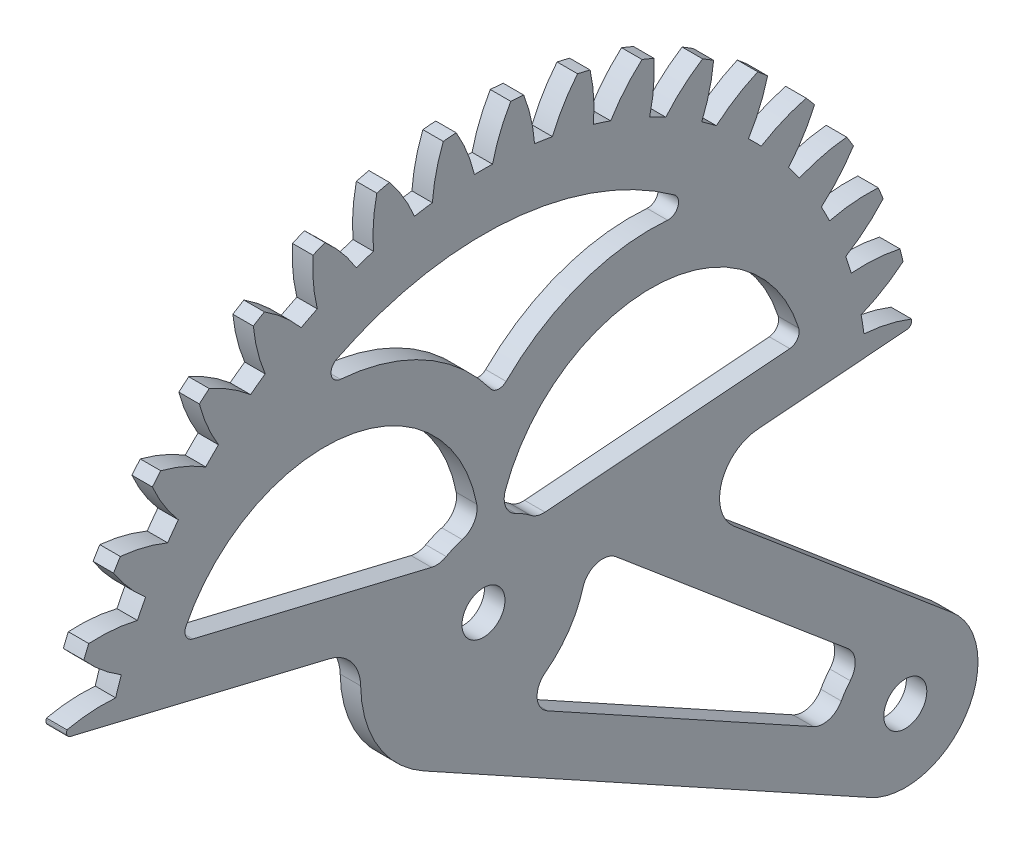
SolidWorks part; units mm, degrees
other "Bore"
ref_plane "Plan de face" through (0, 0, 0) normal (0, 0, 1) x (1, 0, 0)
ref_plane "Plan de dessus" through (0, 0, 0) normal (0, 1, 0) x (1, 0, 0)
ref_plane "Plan de droite" through (0, 0, 0) normal (1, 0, 0) x (0, 0, -1)
imported_body "Importée1"
sketch "Esquisse1" plane through (2, 0, 0) normal (1, 0, 0) x (0, 0, -1)
  line L0 (0, 0) -> (3.2953, 41.8705) construction
  line L1 (11.963, 0.9415) -> (41.8705, 3.2953)
  line L2 (-11.6684, 2.8013) -> (-40.8395, 9.8047)
  line L3 (-11.6684, 2.8013) -> (0, 0) construction
  line L4 (0, 0) -> (11.963, 0.9415) construction
  arc A0 (3.9259, 41.8161) -> (2.664, 41.9154) centre (0, 0) ccw construction
  arc A1 (41.9154, 2.664) -> (41.8161, 3.9259) centre (0, 0) ccw construction
  arc A2 (-40.6872, 10.419) -> (-40.9826, 9.1882) centre (0, 0) ccw construction
  arc A3 (-40.8395, 9.8047) -> (41.8705, 3.2953) centre (0, 0) ccw
  arc A4 (11.963, 0.9415) -> (-11.6684, 2.8013) centre (0, 0) cw
  dimension "D1" = 12
extrude "Enlèv. mat.-Extru.1" cut sketch "Esquisse1" against normal through all
sketch "Esquisse2" plane through (2, 0, 0) normal (1, 0, 0) x (0, 0, -1)
  line L0 (0, 0) -> (3.2953, 41.8705) construction
  line L1 (0, 0) -> (41.2063, -28.3203) construction
  line L2 (45.7819, -22.8913) -> (17.0304, 1.3403)
  line L3 (41.8705, 3.2953) -> (11.963, 0.9415) construction
  line L4 (17.0304, 1.3403) -> (11.963, 0.9415)
  line L5 (-5.795, -10.508) -> (37.7776, -34.5375)
  line L6 (20.6032, -14.1602) -> (26.0385, -6.2517) construction
  line L7 (20.6032, -14.1602) -> (15.1678, -22.0686) construction
  arc A0 (3.9259, 41.8161) -> (2.664, 41.9154) centre (0, 0) ccw construction
  circle A1 centre (41.2063, -28.3203) radius 2.1
  arc A2 (45.7819, -22.8913) -> (37.7776, -34.5375) centre (41.2063, -28.3203) cw
  arc A4 (11.963, 0.9415) -> (-5.795, -10.508) centre (0, 0) cw
  arc A6 (-11.6684, 2.8013) -> (11.963, 0.9415) centre (0, 0) ccw construction
  dimension "D2" = 4.2
  dimension "D4" = 5
  dimension "D1" = 120
  dimension "D3" = 50
extrude "Boss.-Extru.1" add sketch "Esquisse2" against normal up to surface (2 mm away)
fillet "Congé1" radius 4 2 edges at (1, 2.8013, 11.6684) (1, 1.3403, -17.0304)
fillet "Congé2" radius 0.5 2 edges at (1, 9.8047, 40.8395) (1, 3.2953, -41.8705)
sketch "Esquisse3" plane through (0, 0, 0) normal (-1, 0, 0) x (0, 0, 1)
  circle A0 centre (0, 0) radius 4
  circle A1 centre (0, 0) radius 2.1
  circle A2 centre (0, 0) radius 4 construction
  dimension "D1" = 4.2
extrude "Boss.-Extru.2" add sketch "Esquisse3" against normal up to surface (2 mm away)
sketch "Esquisse4" plane through (0, 0, 0) normal (-1, 0, 0) x (0, 0, 1)
  line L2 (13.8967, 8.4784) -> (39.1832, 14.5491)
  line L3 (5.0779, 6.3612) -> (29.5664, 12.2403)
  line L4 (0, 0) -> (-3.2953, 41.8705) construction
  line L5 (-40.9768, 8.2404) -> (-26.3552, 7.0897)
  line L6 (-31.1172, 7.4644) -> (-6.0105, 5.4885)
  line L7 (0, 0) -> (0.4137, 7.4886) construction
  line L10 (-40.1922, -30.1592) -> (3.3804, -6.1297)
  line L11 (-32.2241, -25.7649) -> (-6.2682, -11.4507)
  line L13 (-21.2614, -8.7645) -> (-42.5596, -26.7145)
  line L14 (-12.9365, -1.7483) -> (-35.6017, -20.8505)
  arc A1 (3.6403, 6.5573) -> (2.0734, 7.2077) centre (0, 0) ccw
  arc A2 (17.1292, 27.0294) -> (16.3069, 27.5333) centre (0, 0) ccw
  arc A3 (29.5664, 12.2403) -> (29.4082, 12.6159) centre (0, 0) ccw
  arc A4 (-2.664, 41.9154) -> (-3.9259, 41.8161) centre (0, 0) ccw construction
  arc A5 (0.6622, 9.5071) -> (29.4082, 12.6159) centre (15.5118, 6.6544) cw
  arc A6 (-3.1754, 6.7946) -> (-4.6213, 5.9071) centre (0, 0) ccw
  arc A7 (-2.2113, 18.4505) -> (-17.9756, 24.2022) centre (-16.3618, 4.1459) ccw
  arc A8 (-2.1413, 9.2864) -> (-31.0197, 7.8601) centre (-16.3618, 4.1459) ccw
  arc A9 (-0.7022, 18.5693) -> (13.9682, 26.7162) centre (15.5118, 6.6544) cw
  arc A10 (-31.0197, 7.8601) -> (-31.1172, 7.4644) centre (0, 0) ccw
  arc A11 (14.3396, 28.6073) -> (-18.6382, 26.0119) centre (0, 0) ccw
  arc A12 (-17.9756, 24.2022) -> (-18.6382, 26.0119) centre (-18.0558, 25.199) cw
  arc A13 (-2.2113, 18.4505) -> (-0.7022, 18.5693) centre (-1.508, 19.1615) ccw
  arc A14 (14.3396, 28.6073) -> (13.9682, 26.7162) centre (13.8915, 27.7133) cw
  arc A15 (-6.0105, 5.4885) -> (-4.6213, 5.9071) centre (-5.8536, 7.4823) ccw
  arc A16 (-2.1413, 9.2864) -> (-3.1754, 6.7946) centre (-4.0222, 8.6065) cw
  arc A17 (2.0734, 7.2077) -> (0.6622, 9.5071) centre (2.6263, 9.1298) cw
  arc A18 (5.0779, 6.3612) -> (3.6403, 6.5573) centre (4.611, 8.3059) cw
  circle A21 centre (-41.2063, -28.3203) radius 7.1
  arc A22 (-34.9518, -24.9601) -> (-35.8279, -23.6854) centre (-41.2063, -28.3203) ccw
  arc A23 (-9.7224, -2.7359) -> (-6.0384, -8.0962) centre (0, 0) ccw
  circle A24 centre (0, 0) radius 2.1 construction
  arc A25 (-34.9518, -24.9601) -> (-32.2241, -25.7649) centre (-33.1899, -24.0136) ccw
  arc A26 (-35.8279, -23.6854) -> (-35.6017, -20.8505) centre (-34.3128, -22.3798) cw
  arc A27 (-12.9365, -1.7483) -> (-9.7224, -2.7359) centre (-11.6476, -3.2776) cw
  arc A28 (-6.2682, -11.4507) -> (-6.0384, -8.0962) centre (-7.2341, -9.6994) ccw
  point P32 (-1.3837, 17.5815)
  point P39 (-1.5801, 7.3317)
  dimension "D4" = 15
  dimension "D5" = 1
  dimension "D6" = 5
  dimension "D7" = 1
  dimension "D8" = 2
  dimension "D12" = 8
  dimension "D13" = 2
  dimension "D1" = 10
  dimension "D2" = 5
  dimension "D3" = 5
  dimension "D9" = 5
  dimension "D10" = 5
  dimension "D11" = 5
extrude "Enlèv. mat.-Extru.2" cut sketch "Esquisse4" against normal through all
fillet "Congé3" radius 1 2 edges at (1, 12.2403, 29.5664) (1, 7.4644, -31.1172)
